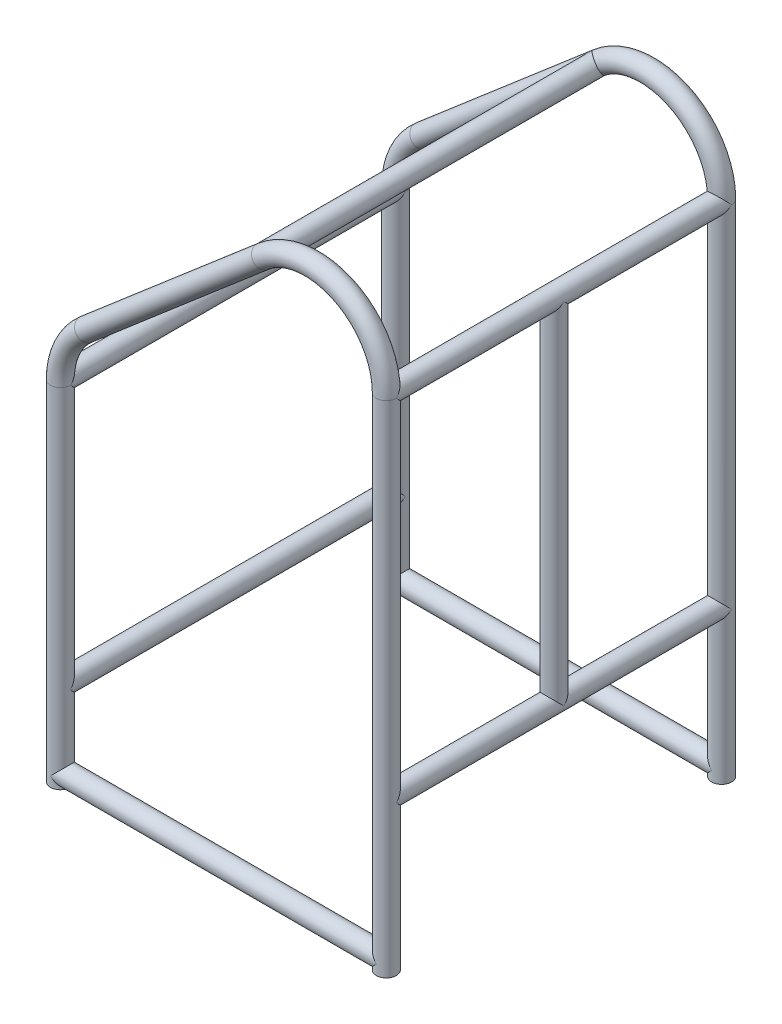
SolidWorks part; units mm, degrees
ref_plane "Front Plane" through (0, 0, 0) normal (0, 0, 1) x (1, 0, 0)
ref_plane "Top Plane" through (0, 0, 0) normal (0, 1, 0) x (1, 0, 0)
ref_plane "Right Plane" through (0, 0, 0) normal (1, 0, 0) x (0, 0, -1)
ref_plane "Plane1" through (0, 0, 180) normal (0, 0, 1) x (1, 0, 0)
sketch "Sketch1" plane through (0, 0, 180) normal (0, 0, 1) x (1, 0, 0)
  line L0 (0, 0) -> (0, 363.2052)
  line L1 (27.9367, 423.9457) -> (217.9367, 586.8029)
  line L2 (350, 526.0623) -> (350, 0)
  line L3 (0, 0) -> (350, 0)
  arc A0 (350, 526.0623) -> (217.9367, 586.8029) centre (270, 526.0623) ccw
  arc A1 (27.9367, 423.9457) -> (0, 363.2052) centre (80, 363.2052) ccw
  point P7 (350, 700)
  point P10 (0, 400)
  dimension "D4" = 80
  dimension "D1" = 350
  dimension "D2" = 300
  dimension "D3" = 400
ref_plane "Plane2" through (0, 0, -180) normal (0, 0, 1) x (1, 0, 0)
sketch "Sketch2" plane through (0, 0, -180) normal (0, 0, 1) x (1, 0, 0)
  line L0 (0, 0) -> (0, 363.2052) construction
  line L1 (27.9367, 423.9457) -> (217.9367, 586.8029) construction
  line L2 (350, 526.0623) -> (350, 0) construction
  line L3 (0, 0) -> (0, 363.2052)
  line L4 (27.9367, 423.9457) -> (217.9367, 586.8029)
  line L5 (350, 526.0623) -> (350, 0)
  line L6 (0, 0) -> (350, 0) construction
  line L7 (0, 0) -> (350, 0)
  arc A0 (27.9367, 423.9457) -> (0, 363.2052) centre (80, 363.2052) ccw construction
  arc A1 (350, 526.0623) -> (217.9367, 586.8029) centre (270, 526.0623) ccw construction
  arc A2 (27.9367, 423.9457) -> (0, 363.2052) centre (80, 363.2052) ccw
  arc A3 (350, 526.0623) -> (217.9367, 586.8029) centre (270, 526.0623) ccw
sketch3d "3DSketch1"
  line L0 (0, 80, -180) -> (0, 80, 180)
  line L1 (0, 0, -180) -> (0, 363.2052, -180) construction
  line L2 (0, 0, 180) -> (0, 363.2052, 180) construction
  line L3 (350, 150, -180) -> (350, 150, 180)
  line L4 (350, 526.0623, -180) -> (350, 0, -180) construction
  line L5 (350, 526.0623, 180) -> (350, 0, 180) construction
  line L6 (350, 526.0623, -180) -> (350, 526.0623, 180)
  line L7 (0, 363.2052, -180) -> (0, 363.2052, 180)
  line L8 (350, 526.0623, 0) -> (350, 150, 0)
  line L9 (217.9367, 586.8029, -180) -> (217.9367, 586.8029, 180)
  dimension "D1" = 80
  dimension "D2" = 150
other "Pipe 21.3 X 2.3(1)"
ref_plane "Plane3" through (0, 0, 180) normal (0, 1, 0) x (-1, 0, 0)
sketch "Sketch11" plane through (0, 0, 180) normal (0, 1, 0) x (-1, 0, 0)
  circle A0 centre (0, 0) radius 8.35
  circle A1 centre (0, 0) radius 10.65
  point P3 (0, 10.65)
  point P5 (-10.65, 0)
  point P6 (0, -10.65)
  point P7 (10.65, 0)
  point P8 (0, 0)
  dimension "In_dia" = 16.7
  dimension "Out_dia" = 21.3
